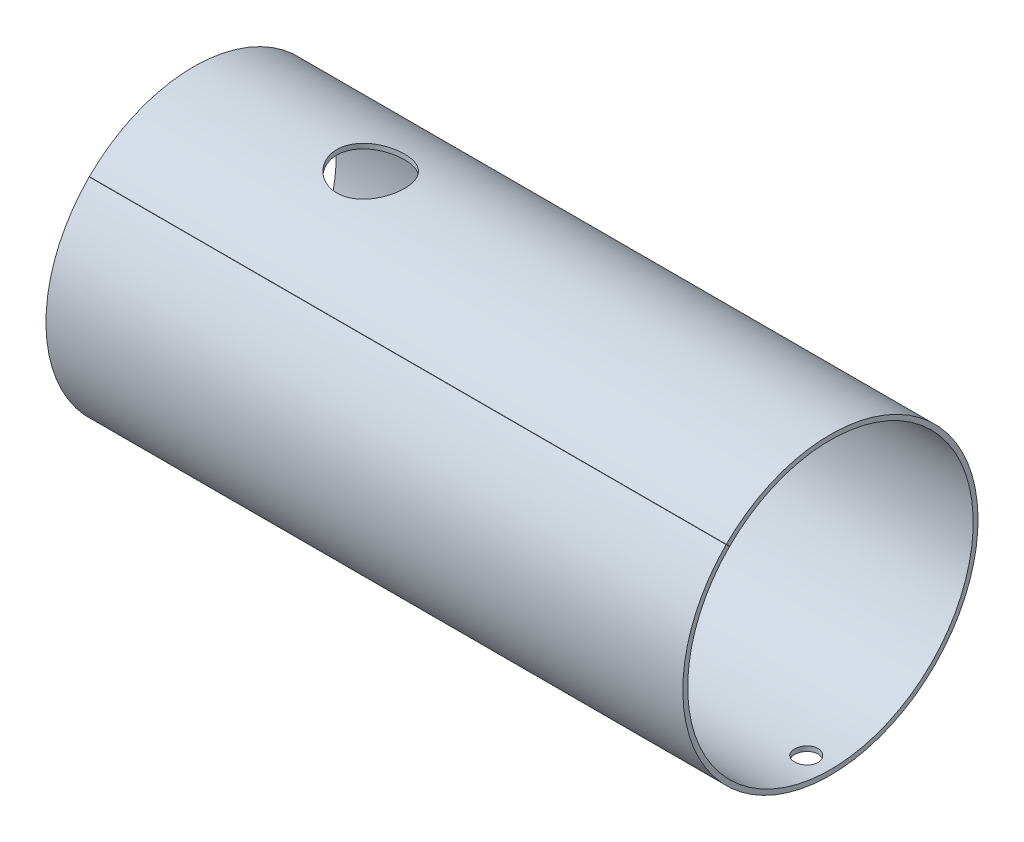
SolidWorks part; units mm, degrees
ref_plane "Plan de face" through (0, 0, 0) normal (0, 0, 1) x (1, 0, 0)
ref_plane "Plan de dessus" through (0, 0, 0) normal (0, 1, 0) x (1, 0, 0)
ref_plane "Plan de droite" through (0, 0, 0) normal (1, 0, 0) x (0, 0, -1)
sketch "Esquisse1" plane through (0, 0, 0) normal (1, 0, 0) x (0, 0, -1)
  circle A0 centre (0, 0) radius 305
  dimension "D1" = 610
extrude "Extru.-Mince1" add sketch "Esquisse1" along normal blind 550 and the other way blind 766 thin
sketch "Esquisse3" plane through (0, 0, 0) normal (0, 1, 0) x (1, 0, 0)
  circle A1 centre (500, 0) radius 24.15
extrude "Enlèv. mat.-Extru.2" cut sketch "Esquisse3" against normal blind 1995.4375
sketch "Esquisse6" plane through (0, 0, 0) normal (0, 1, 0) x (1, 0, 0)
  circle A0 centre (-400, 0) radius 69.85
  circle A1 centre (-400, 0) radius 69.85 construction
extrude "Enlèv. mat.-Extru.3" cut sketch "Esquisse6" along normal blind 700
sketch "Esquisse7" plane through (0, 0, 0) normal (1, 0, 0) x (0, 0, -1)
  line L0 (0, 0) -> (-782.4958, 0) construction
  line L1 (0, 0) -> (-393.5892, 393.5892)
  line L2 (-393.5892, 393.5892) -> (-370.7749, 372.0714)
  line L3 (-370.7749, 372.0714) -> (0, 0)
  dimension "D1" = 45
  dimension "D2" = 0.1
extrude "Enlèv. mat.-Extru.4" cut sketch "Esquisse7" against normal through all and the other way through all
